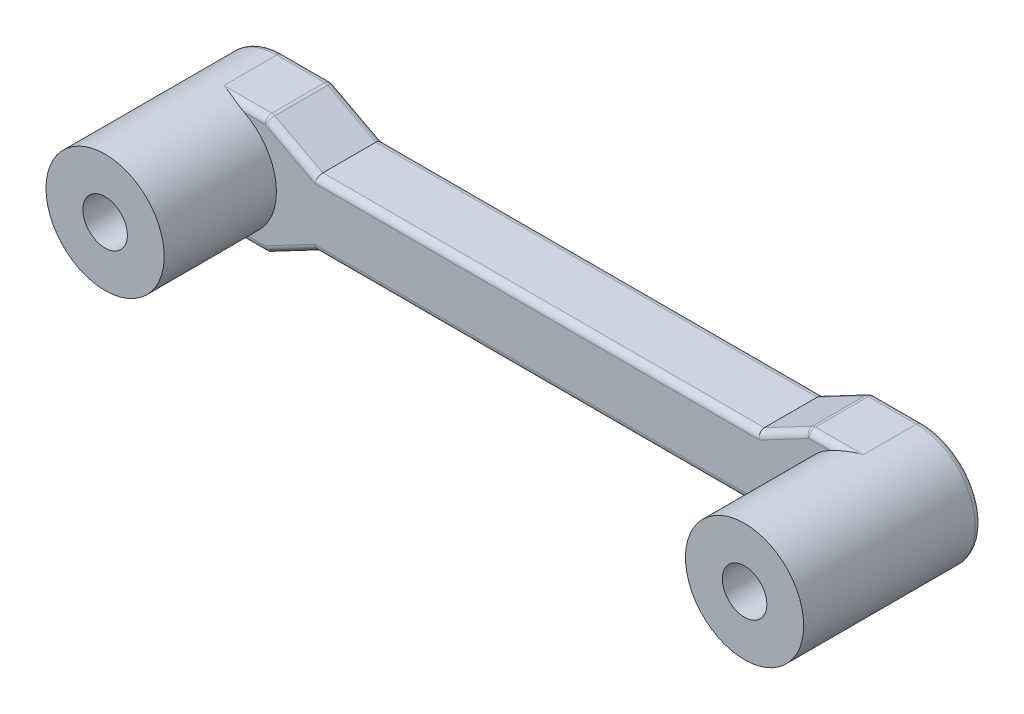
SolidWorks part; units mm, degrees
ref_plane "Front Plane" through (0, 0, 0) normal (0, 0, 1) x (1, 0, 0)
ref_plane "Top Plane" through (0, 0, 0) normal (0, 1, 0) x (1, 0, 0)
ref_plane "Right Plane" through (0, 0, 0) normal (1, 0, 0) x (0, 0, -1)
sketch "Sketch1" plane through (0, 0, 0) normal (0, 0, 1) x (1, 0, 0)
  line L0 (-24.6062, 0) -> (24.6062, 0) construction
  line L1 (-24.6062, 4.548) -> (24.6062, 4.548)
  line L2 (-24.6062, -4.548) -> (24.6062, -4.548)
  line L3 (-24.6062, 3.048) -> (-24.6062, 4.548) construction
  arc A0 (-24.6062, 4.548) -> (-24.6062, -4.548) centre (-24.6062, 0) ccw
  arc A1 (24.6062, -4.548) -> (24.6062, 4.548) centre (24.6062, 0) ccw
  circle A2 centre (-24.6062, 0) radius 3.048
  circle A3 centre (24.6062, 0) radius 3.048
  point P3 (0, 0)
  dimension "0.21" = 6.096
  dimension "D1" = 49.2125
  dimension "D2" = 1.5
extrude "Boss-Extrude1" add sketch "Sketch1" along normal blind 5.08
sketch "Sketch2" plane through (0, 0, 0) normal (0, 0, 1) x (1, 0, 0)
  line L0 (-20.7963, 4.548) -> (-16.9863, 2.54)
  line L1 (24.6062, 4.548) -> (-24.6062, 4.548) construction
  line L2 (-16.9863, 2.54) -> (16.9862, 2.54)
  line L3 (16.9862, 2.54) -> (20.7962, 4.548)
  line L4 (20.7962, 4.548) -> (-20.7963, 4.548)
  line L5 (-16.9863, -2.54) -> (16.9862, -2.54)
  line L6 (16.9862, -2.54) -> (20.7962, -4.548)
  line L7 (-24.6062, -4.548) -> (24.6062, -4.548) construction
  line L8 (20.7962, -4.548) -> (-20.7963, -4.548)
  line L9 (-20.7963, -4.548) -> (-16.9863, -2.54)
  dimension "D1" = 3.81
  dimension "D2" = 7.62
  dimension "D3" = 3.81
  dimension "D4" = 5.08
extrude "Cut-Extrude1" cut sketch "Sketch2" along normal through all
sketch "Sketch3" plane through (0, 0, 5.08) normal (0, 0, 1) x (1, 0, 0)
  circle A0 centre (-24.6062, 0) radius 3.048
  circle A1 centre (-24.6062, 0) radius 3.048 construction
extrude "Boss-Extrude2" add sketch "Sketch3" against normal up to surface (5.08 mm away)
mirror "Mirror1" about plane through (0, 0, 0) normal (1, 0, 0) of "Boss-Extrude2"
fillet "Fillet1" radius 0.508 26 edges at (22.7012, -4.548, 0) (22.7012, -4.548, 5.08) (29.1543, 0, 0) (29.1543, 0, 5.08) (-22.7012, -4.548, 0) (-22.7012, -4.548, 5.08) (-29.1543, 0, 0) (-29.1543, 0, 5.08) (22.7012, 4.548, 0) (22.7012, 4.548, 5.08) (18.8912, 3.544, 0) (18.8912, 3.544, 5.08) (18.8912, -3.544, 0) (18.8912, -3.544, 5.08) (0, -2.54, 0) (0, -2.54, 5.08) (-18.8913, -3.544, 0) (-18.8913, -3.544, 5.08) (0, 2.54, 0) (0, 2.54, 5.08) (-18.8913, 3.544, 0) (-18.8913, 3.544, 5.08) (-22.7012, 4.548, 0) (-22.7012, 4.548, 5.08) (20.7962, 4.548, 2.54) (-20.7963, 4.548, 2.54)
sketch "Sketch4" plane through (0, 0, 5.08) normal (0, 0, 1) x (1, 0, 0)
  circle A0 centre (-24.6062, 0) radius 1.7145
  dimension "D1" = 3.429
extrude "Cut-Extrude2" cut sketch "Sketch4" against normal through all
mirror "Mirror2" about plane through (0, 0, 0) normal (1, 0, 0) of "Cut-Extrude2"
sketch "Sketch5" plane through (0, 0, 0) normal (0, 0, 1) x (1, 0, 0)
  arc A0 (-24.6062, 4.548) -> (-24.6062, -4.548) centre (-24.6062, 0) ccw construction
  arc A1 (-24.6062, 4.548) -> (-24.6062, -4.548) centre (-24.6062, 0) ccw
  circle A4 centre (-24.6062, 0) radius 1.7145
  circle A5 centre (-24.6062, 0) radius 1.7145 construction
  arc A7 (-24.6062, 4.548) -> (-24.6062, -4.548) centre (-24.6062, 0) cw
extrude "Boss-Extrude3" add sketch "Sketch5" along normal blind 9.144 from vertex at 4.572
mirror "Mirror3" about plane through (0, 0, 0) normal (1, 0, 0) of "Boss-Extrude3"
